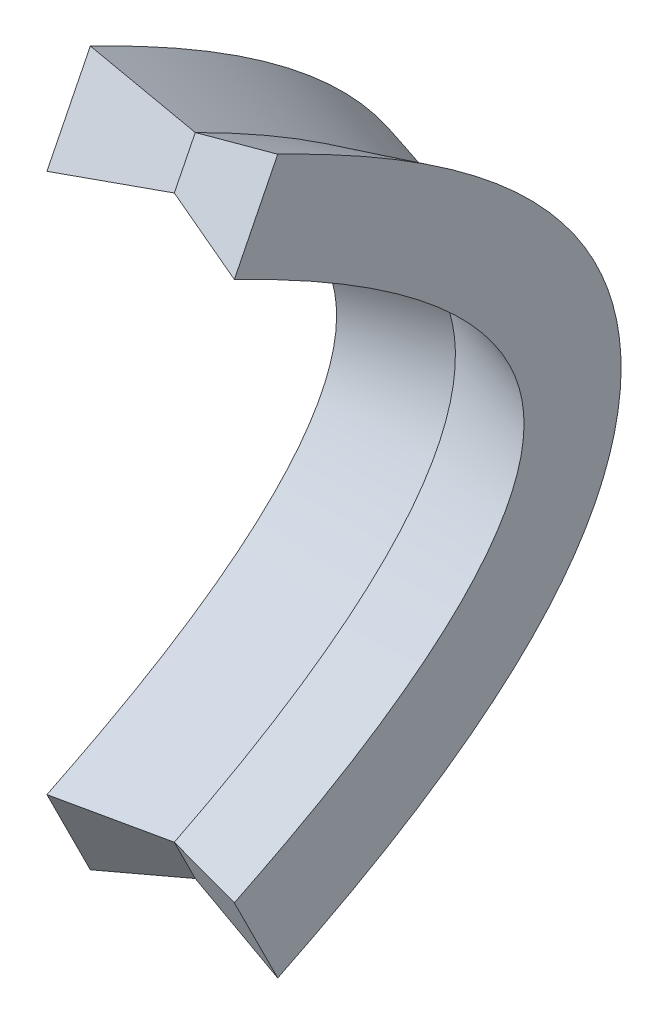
SolidWorks part; units mm, degrees
ref_plane "Front Plane" through (0, 0, 0) normal (0, 0, 1) x (1, 0, 0)
ref_plane "Top Plane" through (0, 0, 0) normal (0, 1, 0) x (1, 0, 0)
ref_plane "Right Plane" through (0, 0, 0) normal (1, 0, 0) x (0, 0, -1)
sketch "Sketch1" plane through (0, 0, 0) normal (-1, 0, 0) x (0, 0, 1)
  parabola Q0
  dimension "D1" = 15
  dimension "D2" = 60
extrude "Extrude-Thin1" add sketch "Sketch1" along normal mid plane 40 draft 15 thin
